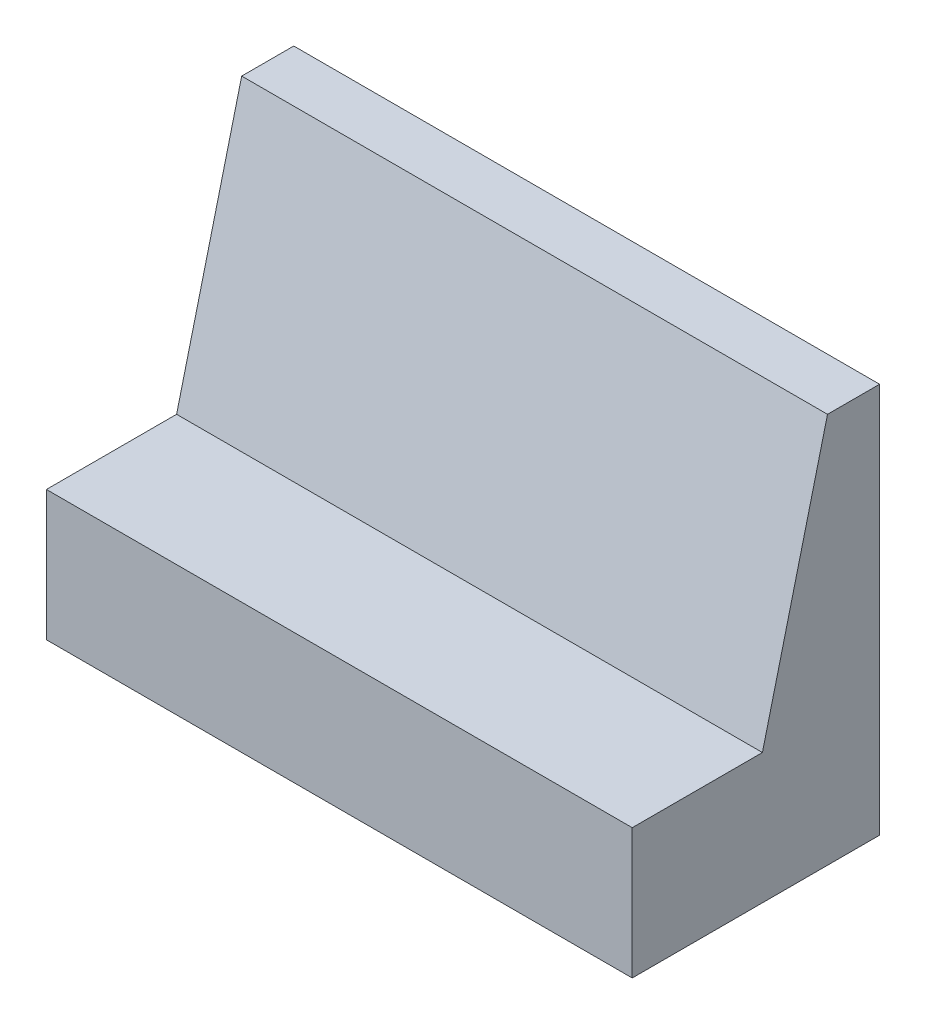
SolidWorks part; units mm, degrees
ref_plane "Front Plane" through (0, 0, 0) normal (0, 0, 1) x (1, 0, 0)
ref_plane "Top Plane" through (0, 0, 0) normal (0, 1, 0) x (1, 0, 0)
ref_plane "Right Plane" through (0, 0, 0) normal (1, 0, 0) x (0, 0, -1)
sketch "Sketch1" plane through (0, 0, 0) normal (1, 0, 0) x (0, 0, -1)
  line L0 (15, 30) -> (10, 10)
  line L1 (0, 0) -> (19, 0)
  line L2 (0, 0) -> (0, 10)
  line L3 (0, 10) -> (10, 10)
  line L4 (19, 0) -> (19, 10)
  line L10 (19, 10) -> (19, 30)
  line L11 (19, 30) -> (15, 30)
  dimension "D1" = 19
  dimension "D2" = 10
  dimension "D3" = 20
  dimension "D4" = 4
  dimension "D5" = 10
  dimension "D6" = 10
extrude "Boss-Extrude1" add sketch "Sketch1" against normal blind 45
sketch "Sketch2" plane through (0, 0, 0) normal (0, -1, 0) x (1, 0, 0)
  line L0 (-45, -10) -> (0, -10) construction
  line L1 (-45, 0) -> (-45, -19) construction
  line L2 (0, 0) -> (0, -19) construction
  line L3 (-45, -19) -> (0, -19) construction
  line L4 (-22.5, 0) -> (-22.5, -19) construction
  line L5 (-45, 0) -> (0, 0) construction
  line L6 (-45, 0) -> (-22.5, 0) construction
  line L7 (-33.75, 0) -> (-33.75, -19) construction
  circle A0 centre (-33.75, -10) radius 4
  circle A1 centre (-11.25, -10) radius 4
  dimension "D2" = 8
  dimension "D3" = 8
  dimension "D1" = 9
  dimension "D4" = 11.25
extrude "Cut-Extrude1" cut sketch "Sketch2" against normal blind 5
